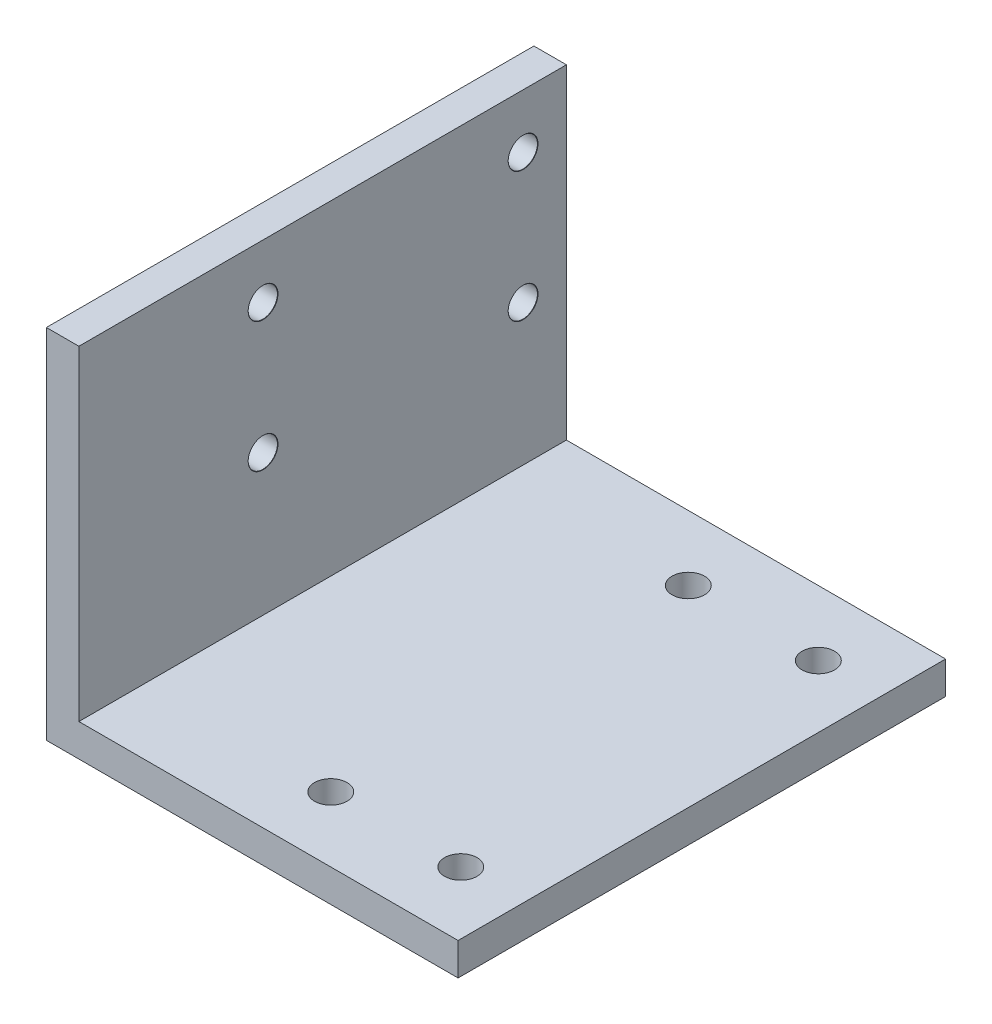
SolidWorks part; units mm, degrees
ref_plane "Front Plane" through (0, 0, 0) normal (0, 0, 1) x (1, 0, 0)
ref_plane "Top Plane" through (0, 0, 0) normal (0, 1, 0) x (1, 0, 0)
ref_plane "Right Plane" through (0, 0, 0) normal (1, 0, 0) x (0, 0, -1)
sketch "Sketch1" plane through (0, 0, 0) normal (0, 1, 0) x (1, 0, 0)
  line L0 (19, 0) -> (-19, 0) construction
  line L1 (-19, -22.5) -> (19, -22.5)
  line L2 (-19, -22.5) -> (-19, 22.5)
  line L3 (-19, 22.5) -> (19, 22.5)
  line L4 (19, -22.5) -> (19, 22.5)
  line L5 (-19, -22.5) -> (19, 22.5) construction
  line L6 (-19, 22.5) -> (19, -22.5) construction
  circle A0 centre (13.25, 16.5) radius 1.5
  circle A1 centre (1.25, 16.5) radius 1.5
  circle A2 centre (13.25, -16.5) radius 1.5
  circle A3 centre (1.25, -16.5) radius 1.5
  point P0 (0, 0)
  dimension "D3" = 5.75
  dimension "D4" = 3
  dimension "D5" = 3
  dimension "D1" = 45
  dimension "D2" = 38
  dimension "D6" = 12
  dimension "D7" = 16.5
extrude "Boss-Extrude1" add sketch "Sketch1" along normal blind 3
sketch "Sketch2" plane through (0, 3, 0) normal (0, 1, 0) x (1, 0, 0)
  line L0 (-19, -22.5) -> (19, -22.5) construction
  line L1 (-16, -22.5) -> (-19, -22.5)
  line L2 (-16, -22.5) -> (-16, 22.5)
  line L3 (-16, 22.5) -> (-19, 22.5)
  line L4 (-19, -22.5) -> (-19, 22.5)
  dimension "D1" = 3
extrude "Boss-Extrude2" add sketch "Sketch2" along normal blind 30
sketch "Sketch3" plane through (-16, 0, 0) normal (1, 0, 0) x (0, 0, -1)
  point P0 (18.5, 28)
  point P3 (18.5, 16)
  point P6 (-5.5, 28)
  point P9 (-5.5, 16)
hole_wizard "M2.5 Clearance Hole1" positions "Sketch3" profile "Sketch4" hole size "M2.5" standard "ANSI Metric"
sketch "Sketch4" plane through (-16, 28, -18.5) normal (0, 1, 0) x (0, 0, -1)
  line L0 (0, 0) -> (0, 6.35)
  line L1 (0, 6.35) -> (1.35, 5.5388)
  line L2 (1.35, 5.5388) -> (1.35, 0.025)
  line L3 (1.35, 0.025) -> (1.375, 0)
  line L5 (1.375, 0) -> (0, 0)
  line L6 (-1.35, 0.025) -> (-1.375, 0) construction
  line L10 (0, 6.35) -> (-1.35, 5.5388) construction
  line L11 (0, -6.35) -> (0, 107.95) construction
  dimension "Hole Dia." = 2.7
  dimension "Hole Depth" = 6.35
  dimension "Near C'Sink Dia." = 2.75
  dimension "Near C'Sink Angle" = 90
  dimension "Drill Angle" = 118
